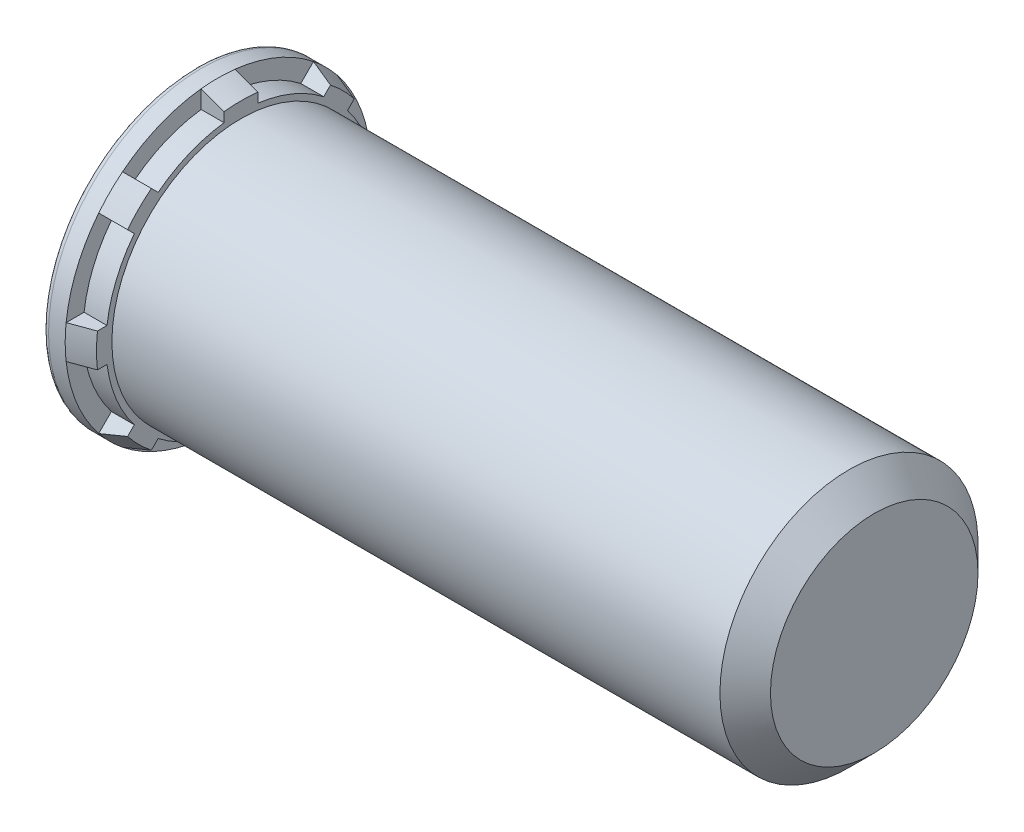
SolidWorks part; units mm, degrees
ref_plane "Plane1" through (0, 0, 0) normal (0, 0, 1) x (1, 0, 0)
ref_plane "Plane2" through (0, 0, 0) normal (0, 1, 0) x (1, 0, 0)
ref_plane "Plane3" through (0, 0, 0) normal (1, 0, 0) x (0, 0, -1)
sketch "BodySke" plane through (0, 0, 0) normal (0, 0, 1) x (1, 0, 0)
  line L0 (-0.4286, 2.7407) -> (-0.4286, 0)
  line L1 (0.4286, 2.7015) -> (0.4286, 2.413)
  line L2 (0, 2.8575) -> (0.4286, 2.7015)
  line L3 (0.4286, 2.413) -> (11.7989, 2.413)
  line L4 (12.2714, 1.9406) -> (12.2714, 0)
  line L5 (12.2714, 0) -> (-0.4286, 0)
  line L6 (0, 0) -> (50.554, 0) construction
  line L7 (-0.4286, 2.7407) -> (-0.4261, 2.7407)
  line L8 (12.2714, 1.9406) -> (11.7989, 2.413)
  line L9 (-0.3118, 2.8575) -> (0, 2.8575)
  line L11 (0.7925, 19.05) -> (0.7925, -3.175) construction
  line L13 (-0.4261, 2.7407) -> (-0.4261, 2.7432)
  arc A0 (-0.4261, 2.7432) -> (-0.3118, 2.8575) centre (-0.3118, 2.7432) cw
  dimension "D2" = 0.0025
  dimension "Fillet_rad" = 0.1143
  dimension "D1" = 20
  dimension "Diameter" = 4.826
  dimension "D3" = 0.0025
  dimension "Head_ht" = 0.8572
  dimension "Length" = 12.7
  dimension "Body_ch_ang" = 45
  dimension "Minor_dia" = 3.8811
  dimension "Advance" = 0.7925
  dimension "H_dia" = 5.715
  dimension "Clinch_ht" = 0.4286
revolve "BaseBody" add sketch "BodySke" angle 360 about L6
sketch "ThdSchSke" plane through (0, 0, 0) normal (0, 0, 1) x (1, 0, 0)
  line L0 (2.1114, -1.9406) -> (1.7806, -2.413)
  line L1 (2.1114, -1.9406) -> (2.4422, -2.413)
  line L2 (2.4422, -2.413) -> (2.4422, -3.0162)
  line L3 (-3.175, 0) -> (5.1513, 0) construction
  line L5 (2.4422, -3.0162) -> (1.7806, -3.0162)
  line L6 (1.7806, -3.0162) -> (1.7806, -2.413)
  line L7 (-0.4286, 2.7407) -> (-0.4286, -2.7407) construction
  dimension "Thread_minor" = 3.8811
  dimension "Diameter" = 4.826
  dimension "Start" = 2.54
  dimension "SideAngle" = 55
  dimension "VeeAngle" = 70
  dimension "Overcut" = 6.0325
revolve "ThreadSchematic" [suppressed] cut sketch "ThdSchSke" angle 360 about L3
pattern_linear "ThdSchPat" [suppressed]
sketch "RibCutSke" plane through (0.4286, 1.7944, -0.091) normal (1, 0, 0) x (0, 0, -1)
  line L0 (0.224, 0.71) -> (0.224, 1.0457)
  line L1 (1.4572, 0.1992) -> (1.6946, 0.4366)
  line L2 (0.224, 0.598) -> (0.224, 0.0891) construction
  line L3 (-0.091, -1.7944) -> (-0.091, 5.0239) construction
  line L4 (-0.091, -1.7944) -> (0.224, 0.598) construction
  line L5 (-0.091, -1.7944) -> (1.378, 0.12) construction
  line L6 (1.378, 0.12) -> (1.0232, -0.2348) construction
  arc A1 (1.4572, 0.1992) -> (0.224, 0.71) centre (-0.091, -1.7944) ccw
  arc A2 (1.6946, 0.4366) -> (0.224, 1.0457) centre (-0.091, -1.7944) ccw
  circle A3 centre (-0.091, -1.7944) radius 2.7015 construction
  circle A4 centre (-0.091, -1.7944) radius 2.413 construction
  dimension "Inner_dia" = 5.0482
  dimension "Outer_dia" = 5.715
  dimension "Rib_root_dia" = 4.826
  dimension "Rib_root_half_angle" = 7.5
  dimension "Rib_root_gap_angle" = 30
  dimension "Angle" = 45
extrude "RibCut" cut sketch "RibCutSke" against normal blind 0.4286
pattern_circular "RibCutsPat" count 8 every 45 about axis through (0, 0, 0) along (1, 0, 0) of "RibCut"
equation "' \"Length@BodySke\" = 0.5"
equation "' \"H_dia@BodySke\" = 0.225"
equation "' \"Start@ThdSchSke\" = 0.1"
equation "' \"Diameter@BodySke\" = 0.19"
equation "' \"Minor_dia@BodySke\" = 0.1528"
equation "' \"Advance@BodySke\" = 0.0312"
equation "\"Fillet_rad@BodySke\" =   \"H_dia@BodySke\" *0.02"
equation "\"Clinch_ht@BodySke\" = \"H_dia@BodySke\" * 0.075"
equation "\"Head_ht@BodySke\" =  \"H_dia@BodySke\" * 0.15"
equation "\"Num_ribs@RibCutsPat\" = 8"
equation "\"Angle@RibCutSke\" =\"Angle@RibCutsPat\""
equation "\"Rib_root_half_angle@RibCutSke\" = \"Angle@RibCutSke\" / 6"
equation "\"Rib_root_gap_angle@RibCutSke\" = \"Angle@RibCutSke\" - (2 * \"Rib_root_half_angle@RibCutSke\" )"
equation "\"Rib_root_dia@RibCutSke\" = \"Diameter@BodySke\""
equation "\"Inner_dia@RibCutSke\" = \"Diameter@BodySke\" + ( \"H_dia@BodySke\" - \"Diameter@BodySke\" ) / 4"
equation "\"Outer_dia@RibCutSke\" = \"H_dia@BodySke\""
equation "\"Depth@RibCut\" = \"Clinch_ht@BodySke\""
equation "\"Thread_length@ThreadCosmetic\" = \"Length@BodySke\" - \"Start@ThdSchSke\""
equation "\"Thread_minor@ThreadCosmetic\" = \"Minor_dia@BodySke\""
equation "\"Thread_minor@ThdSchSke\" = \"Minor_dia@BodySke\""
equation "\"Diameter@ThdSchSke\" = \"Diameter@BodySke\""
equation "\"Overcut@ThdSchSke\" = \"Diameter@BodySke\" * 1.25"
equation "\"Num_threads@ThdSchPat\" = int( \"Thread_length@ThreadCosmetic\" / \"Advance@BodySke\" + 0.999 )  + 1"
equation "\"Advance@ThdSchPat\" = \"Thread_length@ThreadCosmetic\" /  (\"Num_threads@ThdSchPat\" - 1) 'relax it"
equation "\"Num_threads@ThdSchPat\" = \"Num_threads@ThdSchPat\" - sgn( \"Num_threads@ThdSchPat\" - 1) '---chamfered tips only---"
